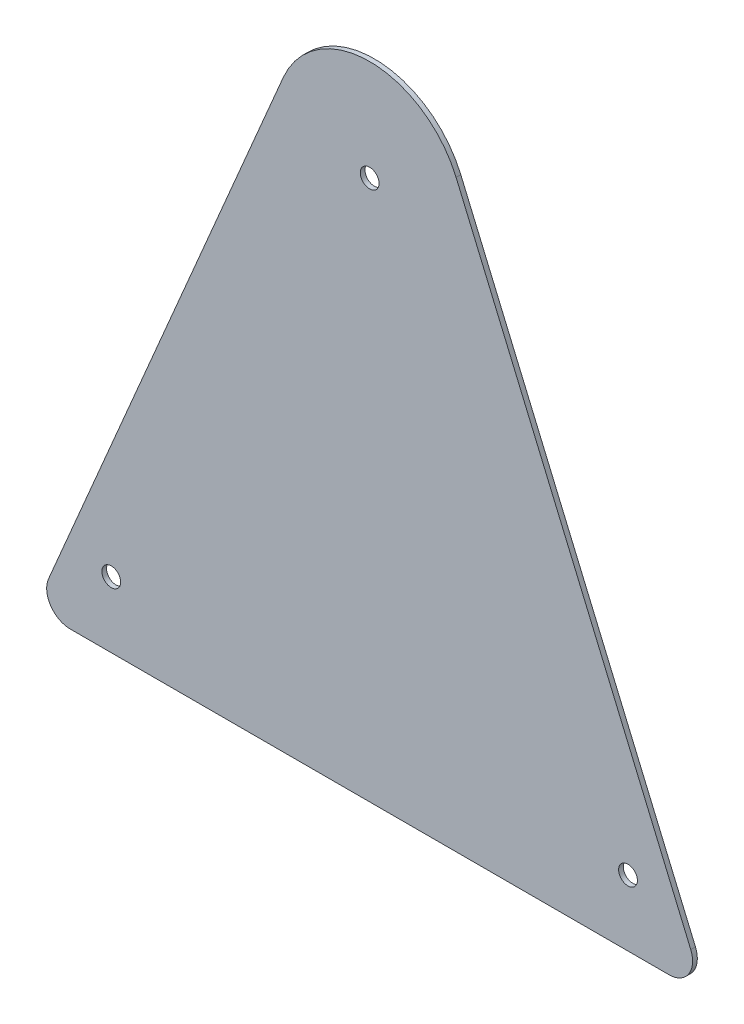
SolidWorks part; units mm, degrees
ref_plane "Plan1" through (0, 0, 0) normal (0, 0, 1) x (1, 0, 0)
ref_plane "Plan2" through (0, 0, 0) normal (0, 1, 0) x (1, 0, 0)
ref_plane "Plan3" through (0, 0, 0) normal (1, 0, 0) x (0, 0, -1)
sketch "Esquisse1" plane through (0, 0, 0) normal (0, 0, 1) x (1, 0, 0)
  line L0 (-127.5, 0) -> (127.5, 0)
  line L1 (136.7015, 13.9157) -> (36.806, 248.6626)
  line L2 (-36.806, 248.6626) -> (-136.7015, 13.9157)
  circle A0 centre (0, 230) radius 4
  circle A1 centre (-110, 28.0099) radius 4
  circle A2 centre (110, 28.0099) radius 4
  arc A3 (36.806, 248.6626) -> (-36.806, 248.6626) centre (0, 233) ccw
  arc A4 (-127.5, 0) -> (-136.7015, 13.9157) centre (-127.5, 10) cw
  arc A5 (127.5, 0) -> (136.7015, 13.9157) centre (127.5, 10) ccw
  point P6 (0, 335.154)
  point P13 (0, 335.154)
  point P15 (0, 273)
  dimension "D3" = 40
  dimension "D10" = 8
  dimension "D2" = 10
  dimension "D5" = 273
  dimension "D9" = 3
  dimension "D12" = 28.0099
  dimension "D1" = 46.104
  dimension "D4" = 230
  dimension "D6" = 230
  dimension "D7" = 230
  dimension "D8" = 255
  dimension "D11" = 19.0506
  dimension "D13" = 73.612
  dimension "D15" = 220
extrude "Base-Extrusion" add sketch "Esquisse1" along normal mid plane 2
